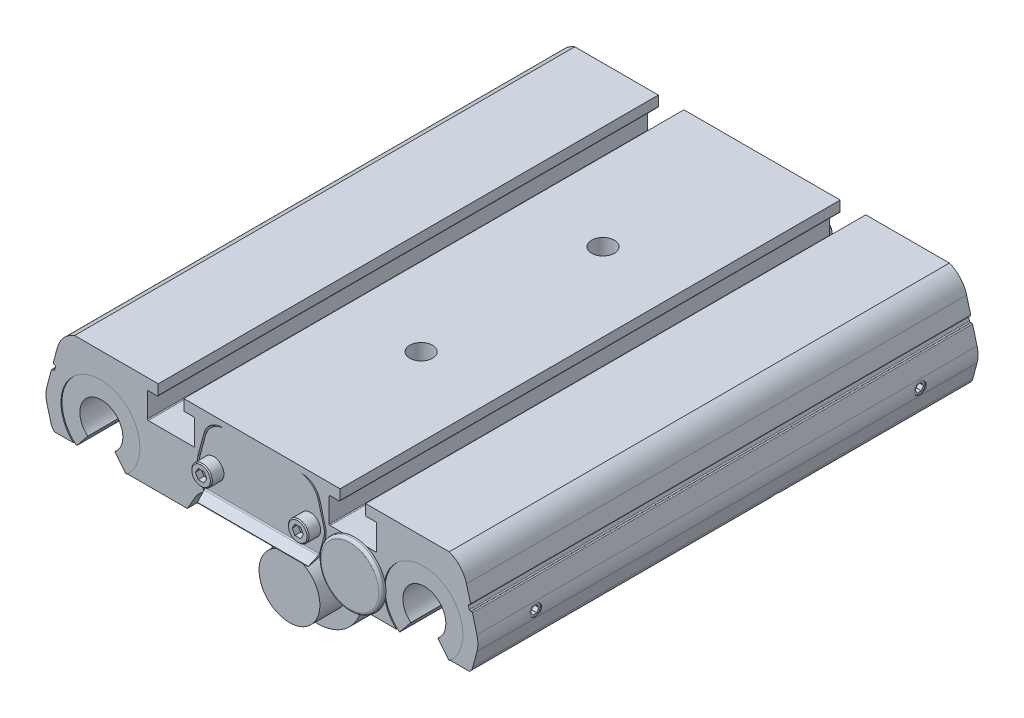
SolidWorks part; units mm, degrees
ref_plane "Front" through (0, 0, 0) normal (0, 0, 1) x (1, 0, 0)
ref_plane "Top" through (0, 0, 0) normal (0, 1, 0) x (1, 0, 0)
ref_plane "Right" through (0, 0, 0) normal (1, 0, 0) x (0, 0, -1)
imported_body "Imported1"
sketch "Sketch1" plane through (0, 0, 151.384) normal (0, 0, 1) x (1, 0, 0)
  line L3 (-37.8488, -7.0508) -> (-31.9846, -12.8135)
  line L4 (-31.225, -14.6473) -> (-31.2913, -22.2455)
  line L5 (-21.8184, -14.257) -> (-33.576, -2.7028)
  line L6 (-37.8488, -7.0508) -> (-31.9846, -12.8135)
  line L7 (-31.225, -14.6473) -> (-31.2913, -22.2455)
  line L8 (-21.8184, -14.257) -> (-33.576, -2.7028)
  arc A3 (-31.225, -14.6473) -> (-31.9846, -12.8135) centre (-33.7649, -14.6252) ccw
  arc A4 (-31.2913, -22.2455) -> (-21.8184, -14.257) centre (-26.1801, -18.6956) ccw
  arc A5 (-33.576, -2.7028) -> (-37.8488, -7.0508) centre (-35.7124, -4.8768) ccw
  arc A6 (-31.225, -14.6473) -> (-31.9846, -12.8135) centre (-33.7649, -14.6252) ccw
  arc A7 (-31.2913, -22.2455) -> (-21.8184, -14.257) centre (-26.1801, -18.6956) ccw
  arc A8 (-33.576, -2.7028) -> (-37.8488, -7.0508) centre (-35.7124, -4.8768) ccw
  dimension "D1" = 0
extrude "Cut-Extrude1" cut sketch "Sketch1" against normal up to surface (13.208 mm away)
sketch "Sketch4" plane through (0, 0, 138.176) normal (0, 0, 1) x (1, 0, 0)
  line L6 (-21.2656, -14.276) -> (-24.8079, -10.795)
  line L7 (-21.2656, -14.276) -> (-24.8079, -10.795)
  line L8 (-24.8079, -10.795) -> (-31.75, -10.795)
  line L9 (-24.8079, -10.795) -> (-31.75, -10.795)
  line L10 (-32.004, -10.541) -> (-32.004, -3.81)
  line L11 (-32.004, -10.541) -> (-32.004, -3.81)
  line L12 (-31.9926, -3.7347) -> (-33.3191, -2.4311)
  line L13 (-31.9926, -3.7347) -> (-33.3191, -2.4311)
  line L14 (-38.126, -7.3225) -> (-32.4849, -12.866)
  line L15 (-38.126, -7.3225) -> (-32.4849, -12.866)
  line L16 (-21.2676, -14.278) -> (-21.2656, -14.276)
  line L17 (-21.2676, -14.278) -> (-21.2656, -14.276)
  arc A1 (-32.004, -10.541) -> (-31.75, -10.795) centre (-31.75, -10.541) ccw
  arc A7 (-32.004, -10.541) -> (-31.75, -10.795) centre (-31.75, -10.541) ccw
  arc A8 (-31.9926, -3.7347) -> (-32.004, -3.81) centre (-31.75, -3.81) ccw
  arc A9 (-31.9926, -3.7347) -> (-32.004, -3.81) centre (-31.75, -3.81) ccw
  arc A10 (-33.3191, -2.4311) -> (-38.126, -7.3225) centre (-35.7226, -4.8768) ccw
  arc A11 (-33.3191, -2.4311) -> (-38.126, -7.3225) centre (-35.7226, -4.8768) ccw
  arc A12 (-31.8376, -16.2814) -> (-32.4849, -12.866) centre (-34.6213, -15.04) ccw
  arc A13 (-31.8376, -16.2814) -> (-32.4849, -12.866) centre (-34.6213, -15.04) ccw
  arc A14 (-31.8376, -16.2814) -> (-21.2676, -14.278) centre (-25.8572, -18.9484) ccw
  arc A15 (-31.8376, -16.2814) -> (-21.2676, -14.278) centre (-25.8572, -18.9484) ccw
  dimension "D1" = 0
extrude "Boss-Extrude2" add sketch "Sketch4" along normal up to surface (1.524 mm away)
sketch "Sketch2" plane through (0, 0, -11.684) normal (0, 0, -1) x (-1, 0, 0)
  line L3 (-37.8488, -7.0508) -> (-31.9846, -12.8135)
  line L4 (-31.225, -14.6473) -> (-31.2913, -22.2455)
  line L5 (-21.8184, -14.257) -> (-33.576, -2.7028)
  line L6 (-37.8488, -7.0508) -> (-31.9846, -12.8135)
  line L7 (-31.225, -14.6473) -> (-31.2913, -22.2455)
  line L8 (-21.8184, -14.257) -> (-33.576, -2.7028)
  arc A3 (-31.225, -14.6473) -> (-31.9846, -12.8135) centre (-33.7649, -14.6252) ccw
  arc A4 (-31.2913, -22.2455) -> (-21.8184, -14.257) centre (-26.1801, -18.6956) ccw
  arc A5 (-33.576, -2.7028) -> (-37.8488, -7.0508) centre (-35.7124, -4.8768) ccw
  arc A6 (-31.225, -14.6473) -> (-31.9846, -12.8135) centre (-33.7649, -14.6252) ccw
  arc A7 (-31.2913, -22.2455) -> (-21.8184, -14.257) centre (-26.1801, -18.6956) ccw
  arc A8 (-33.576, -2.7028) -> (-37.8488, -7.0508) centre (-35.7124, -4.8768) ccw
  dimension "D1" = 0
extrude "Cut-Extrude2" cut sketch "Sketch2" against normal up to surface (13.208 mm away)
sketch "Sketch3" plane through (0, 0, 1.524) normal (0, 0, -1) x (-1, 0, 0)
  line L6 (-21.2656, -14.276) -> (-24.8079, -10.795)
  line L7 (-21.2656, -14.276) -> (-24.8079, -10.795)
  line L8 (-24.8079, -10.795) -> (-31.75, -10.795)
  line L9 (-24.8079, -10.795) -> (-31.75, -10.795)
  line L10 (-32.004, -10.541) -> (-32.004, -3.81)
  line L11 (-32.004, -10.541) -> (-32.004, -3.81)
  line L12 (-31.9926, -3.7347) -> (-33.3191, -2.4311)
  line L13 (-31.9926, -3.7347) -> (-33.3191, -2.4311)
  line L14 (-38.126, -7.3225) -> (-32.4849, -12.866)
  line L15 (-38.126, -7.3225) -> (-32.4849, -12.866)
  line L16 (-21.2676, -14.278) -> (-21.2656, -14.276)
  line L17 (-21.2676, -14.278) -> (-21.2656, -14.276)
  arc A2 (-32.004, -10.541) -> (-31.75, -10.795) centre (-31.75, -10.541) ccw
  arc A9 (-32.004, -10.541) -> (-31.75, -10.795) centre (-31.75, -10.541) ccw
  arc A10 (-31.9926, -3.7347) -> (-32.004, -3.81) centre (-31.75, -3.81) ccw
  arc A11 (-31.9926, -3.7347) -> (-32.004, -3.81) centre (-31.75, -3.81) ccw
  arc A12 (-33.3191, -2.4311) -> (-38.126, -7.3225) centre (-35.7226, -4.8768) ccw
  arc A13 (-33.3191, -2.4311) -> (-38.126, -7.3225) centre (-35.7226, -4.8768) ccw
  arc A14 (-31.8376, -16.2814) -> (-32.4849, -12.866) centre (-34.6213, -15.04) ccw
  arc A15 (-31.8376, -16.2814) -> (-32.4849, -12.866) centre (-34.6213, -15.04) ccw
  arc A16 (-31.8376, -16.2814) -> (-21.2676, -14.278) centre (-25.8572, -18.9484) ccw
  arc A17 (-31.8376, -16.2814) -> (-21.2676, -14.278) centre (-25.8572, -18.9484) ccw
  dimension "D1" = 0
extrude "Boss-Extrude1" add sketch "Sketch3" along normal up to surface (1.524 mm away)
